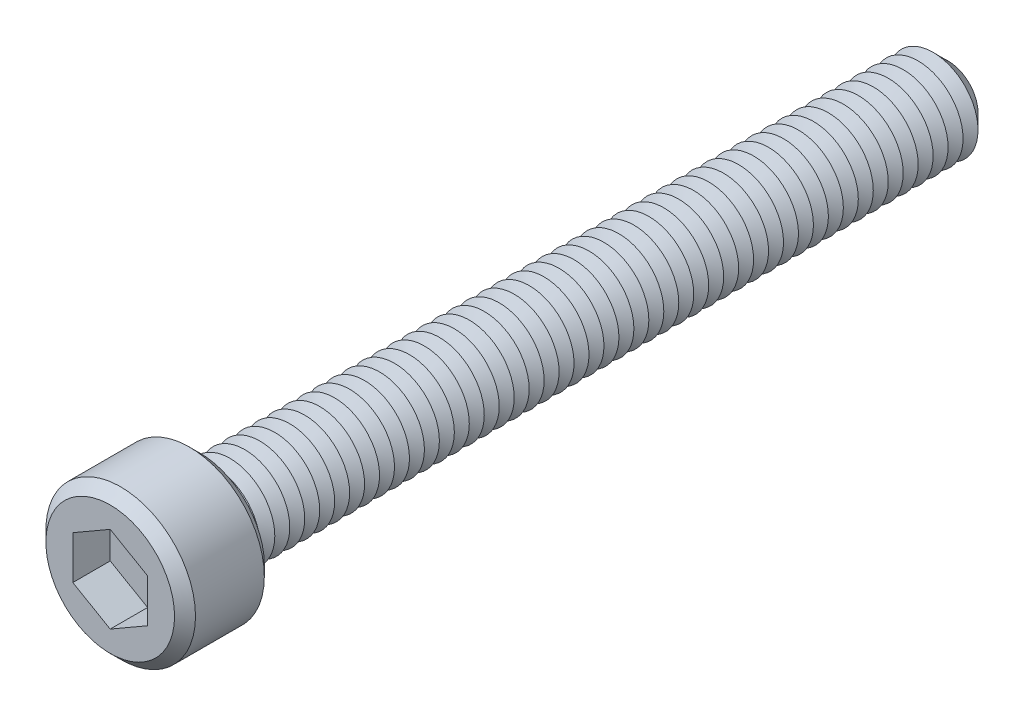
SolidWorks part; units mm, degrees
ref_plane "Front Plane" through (0, 0, 0) normal (0, 0, 1) x (1, 0, 0)
ref_plane "Top Plane" through (0, 0, 0) normal (0, 1, 0) x (1, 0, 0)
ref_plane "Right Plane" through (0, 0, 0) normal (1, 0, 0) x (0, 0, -1)
sketch "Sketch1" plane through (0, 0, 0) normal (0, 0, 1) x (1, 0, 0)
  circle A0 centre (0, 0) radius 5
  dimension "D1" = 10
extrude "Boss-Extrude1" add sketch "Sketch1" along normal blind 6
sketch "Sketch2" plane through (0, 0, 0) normal (0, 0, -1) x (-1, 0, 0)
  circle A0 centre (0, 0) radius 3
  dimension "D1" = 6
extrude "Boss-Extrude2" add sketch "Sketch2" along normal blind 50
chamfer "Chamfer1" distance 1 angle 45 1 edges at (-3, 0, -50)
sketch "Sketch3" plane through (0, 0, 0) normal (1, 0, 0) x (0, 0, -1)
  line L0 (-2.5121, 0) -> (4.5776, 0) construction
sketch "Sketch4" plane through (0, 0, 0) normal (1, 0, 0) x (0, 0, -1)
  line L0 (0, 3) -> (0.5, 2.134)
  line L1 (0.5, 2.134) -> (1, 3)
  line L2 (49, 3) -> (0, 3) construction
  line L3 (1, 3) -> (0, 3)
  dimension "D1" = 1
revolve "Cut-Revolve1" cut sketch "Sketch4" angle 360 about L0
pattern_linear "LPattern1" count 49 spacing 1 along (0, 0, -1) of "Cut-Revolve1"
sketch "Sketch5" plane through (0, 0, 6) normal (0, 0, 1) x (1, 0, 0)
  line L1 (0, 2.8868) -> (-2.5, 1.4434)
  line L2 (-2.5, 1.4434) -> (-2.5, -1.4434)
  line L3 (-2.5, -1.4434) -> (0, -2.8868)
  line L4 (0, -2.8868) -> (2.5, -1.4434)
  line L5 (2.5, -1.4434) -> (2.5, 1.4434)
  line L6 (2.5, 1.4434) -> (0, 2.8868)
  circle A0 centre (0, 0) radius 2.5 construction
  dimension "D1" = 5
extrude "Cut-Extrude1" cut sketch "Sketch5" against normal blind 2.5
sketch "Sketch6" plane through (0, 0, 3.5) normal (0, 0, 1) x (1, 0, 0)
  circle A0 centre (0, 0) radius 0.8
  dimension "D1" = 1.6
extrude "Cut-Extrude2" cut sketch "Sketch6" against normal up to surface (53.5 mm away)
chamfer "Chamfer2" distance 0.7 angle 45 2 edges at (5, 0, 0) (5, 0, 6)
